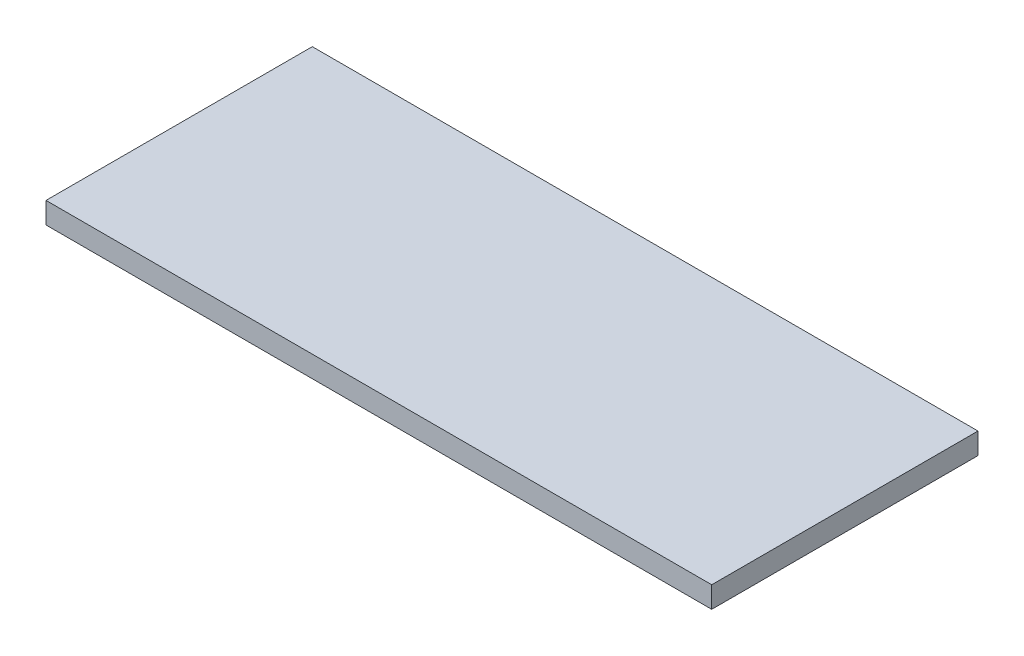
SolidWorks part; units mm, degrees
ref_plane "Front Plane" through (0, 0, 0) normal (0, 0, 1) x (1, 0, 0)
ref_plane "Top Plane" through (0, 0, 0) normal (0, 1, 0) x (1, 0, 0)
ref_plane "Right Plane" through (0, 0, 0) normal (1, 0, 0) x (0, 0, -1)
sketch "Sketch1" plane through (0, 0, 0) normal (0, 1, 0) x (1, 0, 0)
  line L1 (-31.75, 12.7) -> (31.75, 12.7)
  line L2 (-31.75, 12.7) -> (-31.75, -12.7)
  line L3 (-31.75, -12.7) -> (31.75, -12.7)
  line L4 (31.75, 12.7) -> (31.75, -12.7)
  line L5 (-31.75, 12.7) -> (31.75, -12.7) construction
  line L6 (-31.75, -12.7) -> (31.75, 12.7) construction
  point P0 (0, 0)
  dimension "D1" = 25.4
  dimension "D2" = 63.5
extrude "Boss-Extrude1" add sketch "Sketch1" along normal blind 2.032
